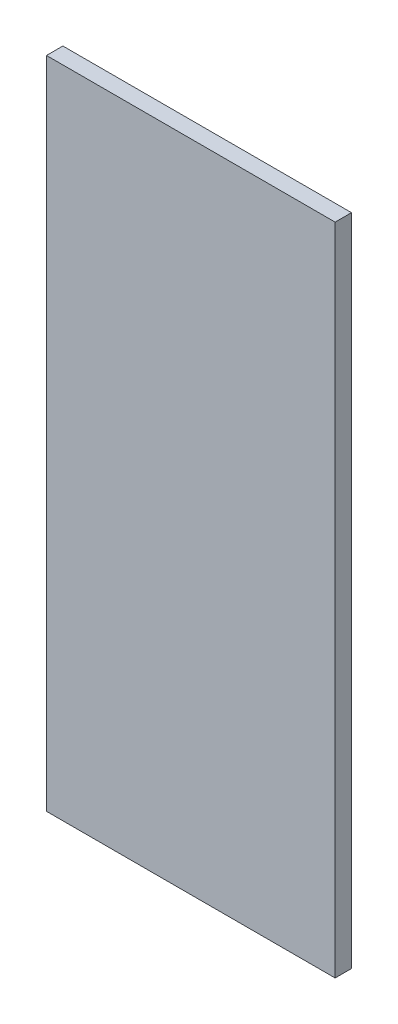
SolidWorks part; units mm, degrees
ref_plane "Front Plane" through (0, 0, 0) normal (0, 0, 1) x (1, 0, 0)
ref_plane "Top Plane" through (0, 0, 0) normal (0, 1, 0) x (1, 0, 0)
ref_plane "Right Plane" through (0, 0, 0) normal (1, 0, 0) x (0, 0, -1)
sketch "Sketch1" plane through (0, 0, 0) normal (0, 1, 0) x (1, 0, 0)
  line L1 (56, -3.175) -> (-56, -3.175)
  line L2 (56, -3.175) -> (56, 3.175)
  line L3 (56, 3.175) -> (-56, 3.175)
  line L4 (-56, -3.175) -> (-56, 3.175)
  line L5 (56, -3.175) -> (-56, 3.175) construction
  line L6 (56, 3.175) -> (-56, -3.175) construction
  point P0 (0, 0)
  dimension "D1" = 6.35
  dimension "D2" = 112
extrude "Boss-Extrude1" add sketch "Sketch1" along normal blind 254
